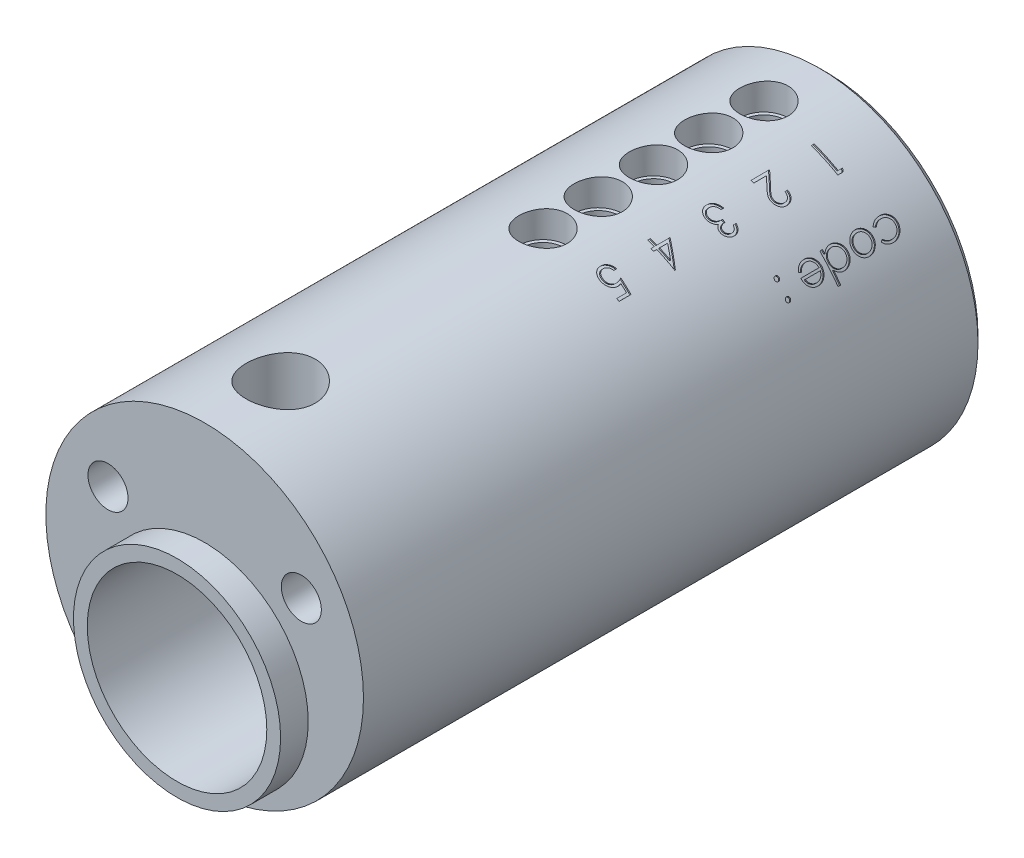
SolidWorks part; units mm, degrees
ref_plane "Plan de face" through (0, 0, 0) normal (0, 0, 1) x (1, 0, 0)
ref_plane "Plan de dessus" through (0, 0, 0) normal (0, 1, 0) x (1, 0, 0)
ref_plane "Plan de droite" through (0, 0, 0) normal (1, 0, 0) x (0, 0, -1)
sketch "Esquisse1" plane through (0, 0, 0) normal (0, 0, 1) x (1, 0, 0)
  circle A0 centre (0, 0) radius 11.5
  dimension "D1" = 23
extrude "Boss.-Extru.1" add sketch "Esquisse1" along normal blind 45
sketch "Esquisse2" plane through (0, 0, 0) normal (0, 0, -1) x (-1, 0, 0)
  line L0 (0, 0) -> (0, -3.5) construction
  circle A0 centre (0, -3.5) radius 6.5
  dimension "D2" = 13
  dimension "D1" = 3.5
extrude "Enlèv. mat.-Extru.1" cut sketch "Esquisse2" against normal through all
sketch "Esquisse3" plane through (0, 0, 0) normal (0, 0, -1) x (-1, 0, 0)
  circle A0 centre (0, -3.5) radius 7
  circle A1 centre (0, -3.5) radius 6.5 construction
  dimension "D1" = 14
extrude "Enlèv. mat.-Extru.2" cut sketch "Esquisse3" against normal blind 1
sketch "Esquisse4" plane through (0, 0, 45) normal (0, 0, 1) x (1, 0, 0)
  circle A0 centre (0, -3.5) radius 6.5 construction
  circle A1 centre (0, -3.5) radius 6.5
  circle A2 centre (0, -3.5) radius 7.5
  dimension "D1" = 15
extrude "Boss.-Extru.2" add sketch "Esquisse4" along normal blind 2
ref_plane "Plan1" through (0, 11.5, 0) normal (0, 1, 0) x (-1, 0, 0)
sketch "Esquisse6" plane through (0, 0, 0) normal (1, 0, 0) x (0, 0, -1)
  line L0 (-39.5, 12.8254) -> (-39.5, 4.5) construction
  line L1 (-39.5, 4.5) -> (-42, 5.9434)
  line L2 (-42, 5.9434) -> (-42, 12.8254)
  line L3 (-42, 12.8254) -> (-39.5, 12.8254)
  line L4 (12.65, 11.5) -> (-12.65, 11.5) construction
  line L5 (-45, 11.5) -> (-45, -11.5) construction
  line L6 (-39.5, 12.8254) -> (-39.5, 4.5)
  dimension "D1" = 60
  dimension "D2" = 7
  dimension "D3" = 5
  dimension "D4" = 1.3254
  dimension "D5" = 5.5
revolve "Enlèvement de matière-Révolution1" cut sketch "Esquisse6" angle 360 about L0
sketch "Esquisse7" plane through (0, 11.5, 0) normal (0, 1, 0) x (-1, 0, 0)
  line L0 (0, 0) -> (0, 26.7957) construction
  circle A0 centre (0, 4.5) radius 1.5
  circle A1 centre (0, 8.5) radius 1.5
  circle A2 centre (0, 12.5) radius 1.5
  circle A3 centre (0, 16.5) radius 1.5
  circle A4 centre (0, 20.5) radius 1.5
  dimension "D1" = 3
  dimension "D2" = 4.5
  dimension "D3" = 4
  dimension "D4" = 4
  dimension "D5" = 4
  dimension "D6" = 4
extrude "Enlèv. mat.-Extru.3" cut sketch "Esquisse7" against normal up to next
sketch "Esquisse8" plane through (0, 11.5, 0) normal (0, 1, 0) x (-1, 0, 0)
  circle A0 centre (0, 20.5) radius 1.75
  circle A1 centre (0, 16.5) radius 1.75
  circle A2 centre (0, 12.5) radius 1.75
  circle A3 centre (0, 8.5) radius 1.75
  circle A4 centre (0, 4.5) radius 1.75
  dimension "D1" = 3.5
extrude "Enlèv. mat.-Extru.4" cut sketch "Esquisse8" against normal blind 2
chamfer "Chanfrein1" distance 0.5 angle 45 1 edges at (11.5, 0, 0)
hole_wizard "Trou taraudé M3.5x0.61" positions "Esquisse10" profile "Esquisse9" tap size "M3.5x0.6" standard "Ansi Métrique"
sketch "Esquisse10" plane through (0, 0, 45) normal (0, 0, 1) x (1, 0, 0)
  line L0 (-7, 4) -> (7, 4) construction
  line L1 (0, 0) -> (0, 4) construction
  circle A1 centre (0, -3.5) radius 6.5 construction
  point P0 (-7, 4)
  point P1 (7, 4)
  point P13 (0, -3.5)
  dimension "D1" = 14
  dimension "D2" = 7.5
sketch "Esquisse9" plane through (-7, 4, 45) normal (1, 0, 0) x (0, -1, 0)
  line L0 (0, 0) -> (0, 10.8712)
  line L1 (0, 10.8712) -> (1.45, 10)
  line L2 (1.45, 10) -> (1.45, 0)
  line L5 (1.45, 0) -> (0, 0)
  line L10 (0, 10.8712) -> (-1.45, 10) construction
  line L11 (0, -6.35) -> (0, 107.95) construction
  dimension "Diamètre du trou pour taraudage" = 2.9
  dimension "Profondeur du trou pour taraudage" = 10
  dimension "Angle de pointe" = 118
sketch "Esquisse11" plane through (0, 0, 0) normal (0, 0, -1) x (-1, 0, 0)
  line L0 (-8.7178, 7.5) -> (8.7178, 7.5) construction
  line L1 (0, 11.5) -> (0, 3.5) construction
  line L2 (12.65, 11.5) -> (-12.65, 11.5) construction
  line L3 (-10.0374, 4.5) -> (10.0374, 4.5) construction
  circle A0 centre (0, 0) radius 11.5 construction
  circle A1 centre (0, -3.5) radius 7 construction
  circle A2 centre (0, 0) radius 11 construction
  text T0 "style" font "Century Gothic" height 2
  text T1 "\"THIRARD\"" font "Century Gothic" height 2
  point P11 (0, 7.5)
  dimension "D1" = 3
extrude "Enlèv. mat.-Extru.5" cut sketch "Esquisse11" against normal blind 0.01
sketch "Esquisse12" plane through (0, 0, 0) normal (0, 0, -1) x (-1, 0, 0)
  line L0 (5.2262, 3.2271) -> (6.7575, 4.7584)
  line L1 (0, 0) -> (-6.6207, 7.8903) construction
  line L2 (0, 0) -> (0, 11.5) construction
  line L3 (12.65, 11.5) -> (-12.65, 11.5) construction
  line L4 (-5.2262, 3.2271) -> (-6.7575, 4.7584)
  line L5 (-5.403, 3.0503) -> (-6.9342, 4.5816)
  line L6 (5.403, 3.0503) -> (6.9342, 4.5816)
  arc A0 (6.6207, 7.8903) -> (-6.6207, 7.8903) centre (0, 0) ccw
  circle A1 centre (0, -3.5) radius 6.5 construction
  circle A2 centre (0, 0) radius 11 construction
  arc A3 (3.9997, 3.0797) -> (-3.9997, 3.0797) centre (0, -3.5) ccw
  circle A4 centre (0, -3.5) radius 7 construction
  arc A5 (-5.2262, 3.2271) -> (-3.9997, 3.0797) centre (-4.5191, 3.9342) ccw
  arc A6 (-6.6207, 7.8903) -> (-6.7575, 4.7584) centre (-5.2542, 6.2617) ccw
  arc A7 (5.2262, 3.2271) -> (3.9997, 3.0797) centre (4.5191, 3.9342) cw
  arc A8 (6.6207, 7.8903) -> (6.7575, 4.7584) centre (5.2542, 6.2617) cw
  arc A9 (6.7814, 8.0818) -> (-6.7814, 8.0818) centre (0, 0) ccw
  arc A10 (-6.7814, 8.0818) -> (-6.9342, 4.5816) centre (-5.2542, 6.2617) ccw
  arc A11 (-5.403, 3.0503) -> (-3.8698, 2.8661) centre (-4.5191, 3.9342) ccw
  arc A12 (3.8698, 2.8661) -> (-3.8698, 2.8661) centre (0, -3.5) ccw
  arc A13 (5.403, 3.0503) -> (3.8698, 2.8661) centre (4.5191, 3.9342) cw
  arc A14 (6.7814, 8.0818) -> (6.9342, 4.5816) centre (5.2542, 6.2617) cw
  dimension "D1" = 0.7
  dimension "D2" = 0.7
  dimension "D5" = 2.126
  dimension "D6" = 1
  dimension "D3" = 45
  dimension "D4" = 40
  dimension "D7" = 0.25
extrude "Enlèv. mat.-Extru.6" cut sketch "Esquisse12" against normal blind 0.01 contours A14 A9 A10 L5 A11 A12 A13 L6 A0 A8 L0 A7 A3 A5 L4 A6
ref_plane "Plan2" through (0, 0, 0) normal (0.7071, 0.7071, 0) x (-0.7071, 0.7071, 0)
ref_plane "Plan3" through (8.1317, 8.1317, 0) normal (0.7071, 0.7071, 0) x (-0.7071, 0.7071, 0)
sketch "Esquisse13" plane through (8.1317, 8.1317, 0) normal (0.7071, 0.7071, 0) x (-0.7071, 0.7071, 0)
  line L0 (0, 3.2896) -> (0, 45) construction
  line L1 (11.5, 45) -> (-11.5, 45) construction
  text T0 "code :   1   2   3   4   5" font "Century Gothic" height 2
  dimension "D1" = 3.25
extrude "Enlèv. mat.-Extru.7" cut sketch "Esquisse13" against normal offset from surface (0.123 mm away) 0.1
